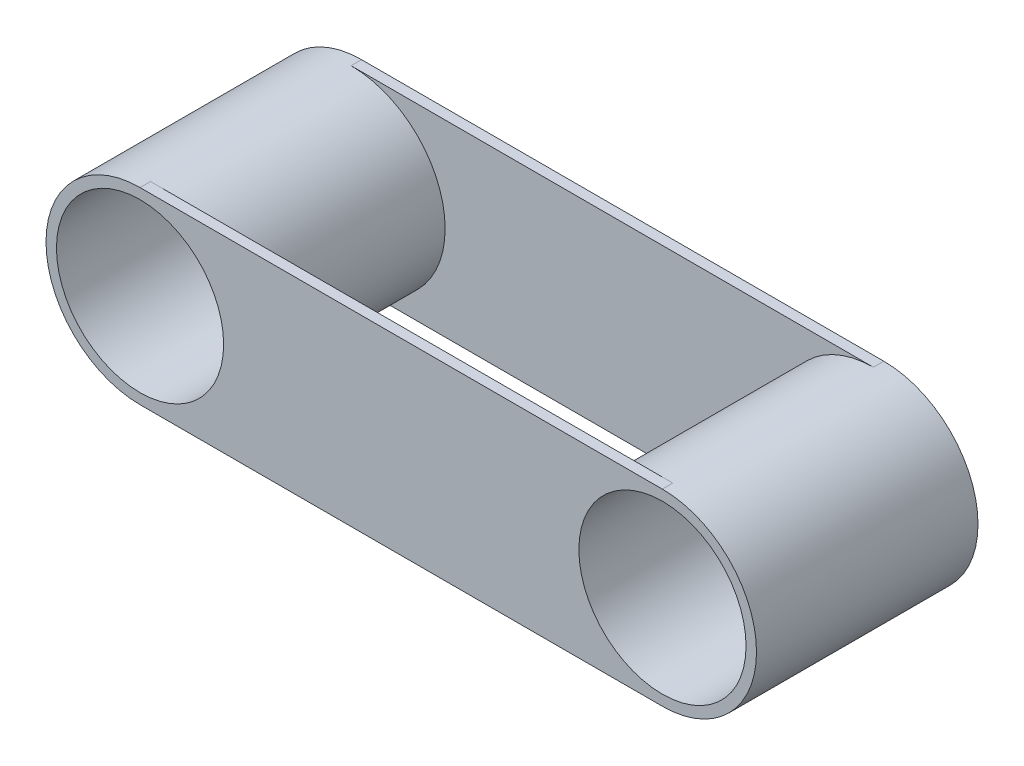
SolidWorks part; units mm, degrees
ref_plane "Front Plane" through (0, 0, 0) normal (0, 0, 1) x (1, 0, 0)
ref_plane "Top Plane" through (0, 0, 0) normal (0, 1, 0) x (1, 0, 0)
ref_plane "Right Plane" through (0, 0, 0) normal (1, 0, 0) x (0, 0, -1)
sketch "Sketch1" plane through (0, 0, 0) normal (0, 0, 1) x (1, 0, 0)
  circle A0 centre (0, 0) radius 90
  circle A1 centre (0, 0) radius 80
  dimension "D1" = 180
  dimension "D2" = 10
extrude "Boss-Extrude1" add sketch "Sketch1" along normal mid plane 212
sketch "Sketch2" plane through (0, 0, 106) normal (0, 0, 1) x (1, 0, 0)
  line L0 (0, 0) -> (499.88, 0) construction
  line L1 (0, 90) -> (499.88, 90)
  line L2 (499.88, 90) -> (499.88, -90)
  line L3 (499.88, -90) -> (0, -90)
  circle A0 centre (0, 0) radius 90 construction
  arc A1 (0, -90) -> (0, 90) centre (0, 0) ccw
  dimension "D1" = 499.88
extrude "Boss-Extrude2" add sketch "Sketch2" against normal blind 10 contours L1 L2 L3 A1
ref_plane "Plane1" through (0, 0, 0) normal (0, 0, 1) x (1, 0, 0)
mirror "Mirror1" about plane through (0, 0, 0) normal (0, 0, 1) of "Boss-Extrude2"
ref_plane "Plane2" through (500, 0, 0) normal (1, 0, 0) x (0, 0, -1)
ref_plane "Plane3" through (250, 0, 0) normal (1, 0, 0) x (0, 0, -1)
mirror "Mirror2" about plane through (250, 0, 0) normal (1, 0, 0) of "Boss-Extrude1"
sketch "Sketch3" plane through (0, 0, -96) normal (0, 0, 1) x (1, 0, 0)
  line L1 (499.88, -79.9999) -> (499.88, 79.9999)
  line L2 (499.88, -79.9999) -> (499.88, 79.9999)
  arc A1 (499.88, 79.9999) -> (499.88, -79.9999) centre (500, 0) ccw
  arc A2 (499.88, 79.9999) -> (499.88, -79.9999) centre (500, 0) ccw
  dimension "D1" = 0
extrude "Cut-Extrude1" cut sketch "Sketch3" against normal through all both and the other way through all
